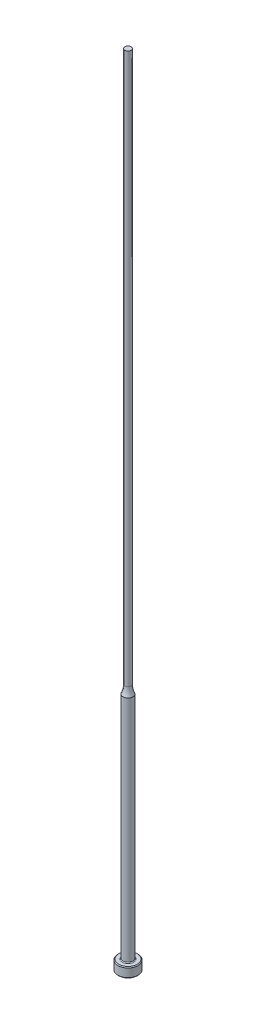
SolidWorks part; units mm, degrees
ref_plane "Front Plane" through (0, 0, 0) normal (0, 0, 1) x (1, 0, 0)
ref_plane "Top Plane" through (0, 0, 0) normal (0, 1, 0) x (1, 0, 0)
ref_plane "Right Plane" through (0, 0, 0) normal (1, 0, 0) x (0, 0, -1)
sketch "Sketch1" plane through (0, 0, 0) normal (0, 0, 1) x (1, 0, 0)
  line L0 (0, 259.9588) -> (0, -15.1925) construction
  line L1 (0, 0) -> (-3.175, 0)
  line L2 (-3.175, 0) -> (-3.175, 3.175)
  line L3 (-3.175, 3.175) -> (-1.5875, 3.175)
  line L4 (-0.9919, 78.8851) -> (-0.9919, 254)
  line L5 (-0.9919, 254) -> (0, 254)
  line L6 (0, 254) -> (0, 0)
  line L7 (-1.5875, 3.175) -> (-1.5875, 76.2)
  arc A0 (-1.5875, 76.2) -> (-0.9919, 78.8851) centre (-7.3419, 78.8851) ccw
  point P13 (-1.5875, 0)
  dimension "D1" = 6.35
  dimension "L" = 254
  dimension "D2" = 3.175
  dimension "H" = 6.35
  dimension "T" = 3.175
  dimension "D" = 1.9837
  dimension "S" = 76.2
revolve "Revolve1" add sketch "Sketch1" angle 360 about L0
chamfer "Chamfer1" distance 0.254 angle 45 2 edges at (0, 3.175, 3.175) (0, 0, 3.175)
fillet "Fillet1" radius 0.254 1 edges at (0, 3.175, 1.5875)
